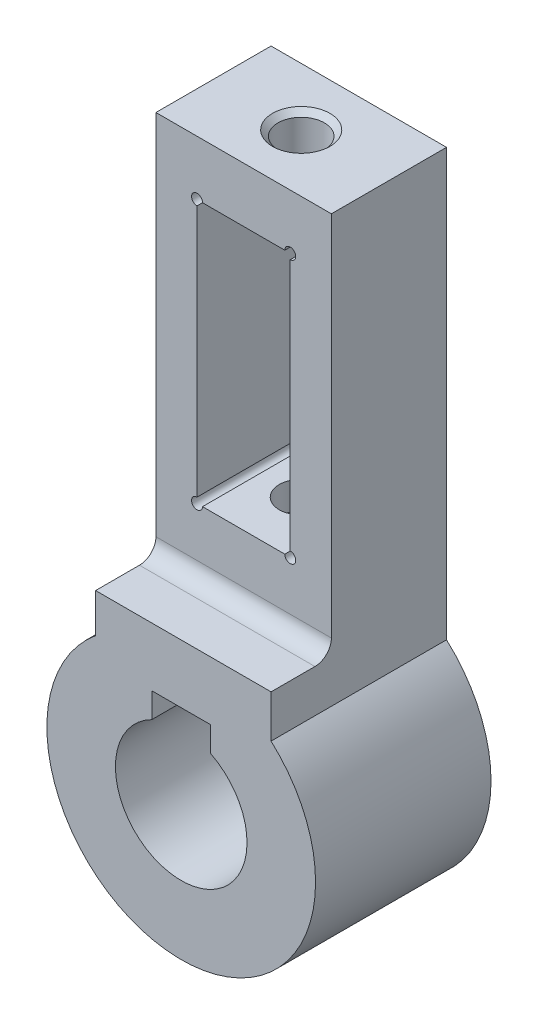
SolidWorks part; units mm, degrees
ref_plane "Front Plane" through (0, 0, 0) normal (0, 0, 1) x (1, 0, 0)
ref_plane "Top Plane" through (0, 0, 0) normal (0, 1, 0) x (1, 0, 0)
ref_plane "Right Plane" through (0, 0, 0) normal (1, 0, 0) x (0, 0, -1)
sketch "Sketch1" plane through (0, 0, 0) normal (0, 0, 1) x (1, 0, 0)
  line L0 (0, 24) -> (0, -24) construction
  line L5 (-16, 34) -> (16, 34)
  line L6 (-16, 34) -> (-16, -36)
  line L7 (-8.5, 24) -> (8.5, 24)
  line L8 (-8.5, 24) -> (-8.5, -24)
  line L9 (-8.5, -24) -> (8.5, -24)
  line L10 (8.5, 24) -> (8.5, -24)
  line L11 (-8.5, 24) -> (8.5, -24) construction
  line L12 (-8.5, -24) -> (8.5, 24) construction
  line L13 (-16, -36) -> (16, -36)
  line L14 (16, 34) -> (16, -36)
  line L18 (-8.5, 0) -> (8.5, 0) construction
  circle A0 centre (-8.5, 24) radius 1
  circle A1 centre (8.5, 24) radius 1
  circle A2 centre (-8.5, -24) radius 1
  circle A3 centre (8.5, -24) radius 1
  point P0 (0, 0)
  point P1 (0, 0)
  point P7 (0, 0)
  dimension "D3" = 2
  dimension "D1" = 48
  dimension "D2" = 17
  dimension "D4" = 32
  dimension "D5" = 10
  dimension "D6" = 70
extrude "Boss-Extrude1" add sketch "Sketch1" along normal blind 21 contours L14 L5 L6 L13 A3 L9 A2 L8 A0 L7 A1 L10
sketch "Sketch3" plane through (0, 0, 0) normal (0, 0, 1) x (1, 0, 0)
  line L1 (-16, -36) -> (16, -36)
  line L2 (-16, -36) -> (-16, -52.8938)
  line L3 (-16, -52.8938) -> (16, -52.8938)
  line L4 (16, -36) -> (16, -52.8938)
  line L5 (-16, -36) -> (16, -36) construction
  line L6 (-5.7574, -51.2703) -> (4.9894, -51.2703)
  line L7 (-5.7574, -51.2703) -> (-5.7574, -46.7)
  line L8 (-5.7574, -46.7) -> (4.9894, -46.7)
  line L9 (4.9894, -51.2703) -> (4.9894, -46.7)
  line L10 (-16, 34) -> (16, 34) construction
  circle A0 centre (-0.384, -62) radius 24.5
  circle A1 centre (-0.384, -62) radius 12
  point P16 (-0.384, -74)
  dimension "D3" = 49
  dimension "D4" = 24
  dimension "D1" = 32
  dimension "D2" = 26
  dimension "D5" = 27.3
  dimension "D6" = 96
extrude "Boss-Extrude2" add sketch "Sketch3" along normal blind 32 contours A0 L4 L1 L2 | A1 L3 L2 A0 L4 | A1 L3 L4 A0 L2 L7 L8 L9
fillet "Fillet1" radius 3 1 edges at (0, -36, 21)
sketch "Sketch4" plane through (0, 34, 0) normal (0, 1, 0) x (1, 0, 0)
  line L0 (0, 0) -> (0, -21) construction
  line L1 (-16, -21) -> (16, -21) construction
  circle A0 centre (0, -10.5) radius 4.2313
  point P5 (0, -21)
extrude "Cut-Extrude1" cut sketch "Sketch4" against normal blind 32
chamfer "Chamfer1" distance 1 angle 45 1 edges at (0, 34, 14.7313)
hole_wizard "Ø8.0mm Dowel Hole1" positions "3DSketch1" profile "Sketch6" hole size "Ø8.0" standard "ISO"
sketch3d "3DSketch1"
  line L0 (0, -24, 10.5) -> (0, -24, 21) construction
  line L1 (-7.5, -24, 21) -> (7.5, -24, 21) construction
  line L2 (0, -24, 10.5) -> (7.5, -24, 10.5) construction
  line L3 (7.5, -24, 21) -> (7.5, -24, 0) construction
  point P0 (0, -24, 10.5)
sketch "Sketch6" plane through (0, -24, 10.5) normal (1, 0, 0) x (0, 0, 1)
  line L0 (0, 0) -> (0, 7.4034)
  line L1 (0, 7.4034) -> (4, 5)
  line L2 (4, 5) -> (4, 0)
  line L5 (4, 0) -> (0, 0)
  line L10 (0, 7.4034) -> (-4, 5) construction
  line L11 (0, -6.35) -> (0, 107.95) construction
  dimension "Hole Dia." = 8
  dimension "Hole Depth" = 5
  dimension "Drill Angle" = 118
